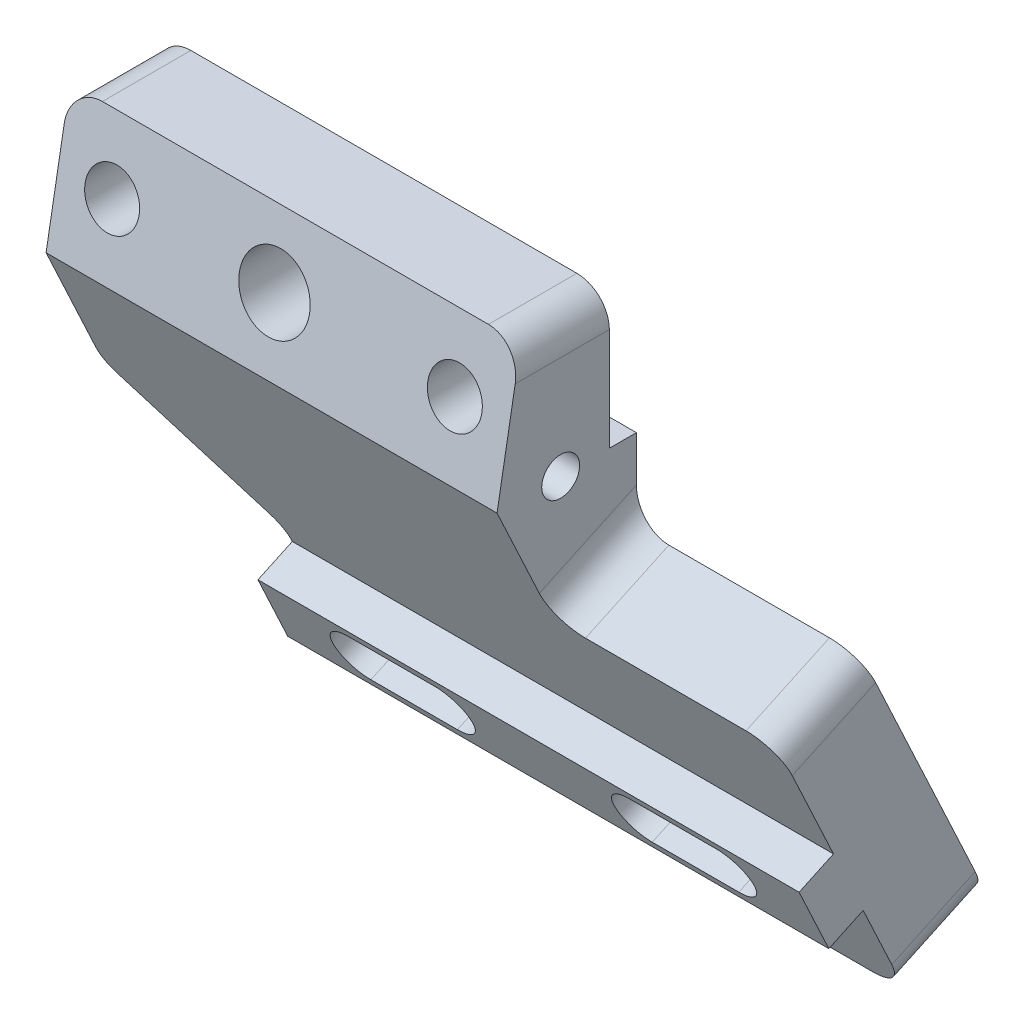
SolidWorks part; units mm, degrees
ref_plane "Front Plane" through (0, 0, 0) normal (0, 0, 1) x (1, 0, 0)
ref_plane "Top Plane" through (0, 0, 0) normal (0, 1, 0) x (1, 0, 0)
ref_plane "Right Plane" through (0, 0, 0) normal (1, 0, 0) x (0, 0, -1)
sketch "Sketch10" plane through (0, 0, 0) normal (1, 0, 0) x (0, 0, -1)
  line L0 (3.752, -2.0289) -> (3.752, 22.9711)
  line L1 (3.752, 22.9711) -> (-12.5918, 22.9711)
  line L2 (-12.5918, 22.9711) -> (-17, -2.0289)
  line L3 (-17, -2.0289) -> (16.8095, -74.5335)
  line L4 (16.8095, -74.5335) -> (32.2167, -67.349)
  line L5 (8.752, -17.0289) -> (32.2167, -67.349)
  line L6 (-17, -2.0289) -> (-46.0302, 60.2265) construction
  line L7 (3.752, -2.0289) -> (8.752, -2.0289)
  line L8 (8.752, -2.0289) -> (8.752, -17.0289)
  line L9 (32.2167, -67.349) -> (32.2167, 55.5953) construction
  line L10 (3.752, -2.0289) -> (-44.3046, -2.0289) construction
  dimension "D1" = 5
  dimension "D2" = 35
  dimension "D3" = 80
  dimension "D4" = 25
  dimension "D5" = 17
  dimension "D6" = 25
  dimension "D7" = 40
extrude "Extrude5" add sketch "Sketch10" along normal blind 125
sketch "Sketch11" plane through (0, 0.3108, -0.6664) normal (0, 0.4226, -0.9063) x (-1, 0, 0)
  line L0 (0, -19.1322) -> (-25, -40.1097)
  line L1 (-25, -40.1097) -> (-25, -74.6543)
  line L2 (-125, -74.6543) -> (0, -74.6543) construction
  line L3 (-125, -19.1322) -> (0, -19.1322) construction
  line L4 (-125, -74.6543) -> (-125, -19.1322) construction
  line L5 (0, -19.1322) -> (0, -74.6543)
  line L6 (0, -74.6543) -> (-25, -74.6543)
  dimension "D1" = 40
  dimension "D2" = 100
extrude "Cut-Extrude1" cut sketch "Sketch11" against normal up to surface (17 mm away)
ref_plane "Plane4" through (0, -17.3397, -8.0856) normal (0, -0.9063, -0.4226) x (1, 0, 0)
sketch "Sketch13" plane through (125, 0, 0) normal (1, 0, 0) x (0, 0, -1)
  line L0 (8.752, -17.0289) -> (-6.6552, -24.2134)
  line L1 (-22.1619, -31.4443) -> (38.3332, -3.235) construction
  line L2 (-17, -2.0289) -> (16.8095, -74.5335) construction
  line L3 (8.752, -17.0289) -> (8.752, -2.0289)
  line L4 (8.752, -2.0289) -> (3.752, -2.0289)
  line L5 (3.752, -2.0289) -> (3.752, 22.9711)
  line L6 (3.752, 22.9711) -> (-12.5918, 22.9711)
  line L7 (-12.5918, 22.9711) -> (-17, -2.0289)
  line L8 (-17, -2.0289) -> (-6.6552, -24.2134)
extrude "Cut-Extrude2" cut sketch "Sketch13" against normal blind 41.6667
fillet "Fillet1" radius 6 8 edges at (125, -70.9413, -24.5131) (125, -20.6212, -1.0484) (83.3333, -20.6212, -1.0484) (83.3333, 22.9711, 4.4199) (0, 22.9711, 4.4199) (0, -20.6212, -1.0484) (25, -39.6332, -9.9139) (25, -70.9413, -24.5131)
sketch "Sketch15" plane through (0, 0, 0) normal (-1, 0, 0) x (0, 0, 1)
  line L0 (17, -2.0289) -> (-3.752, -2.0289) construction
  circle A0 centre (5.248, -2.0289) radius 3.5
  dimension "D1" = 7
  dimension "D2" = 9
extrude "Cut-Extrude3" cut sketch "Sketch15" against normal through all
sketch "Sketch16" plane through (0, 0, -3.752) normal (0, 0, -1) x (-1, 0, 0)
  line L0 (0, -2.0289) -> (0, 16.9711) construction
  line L1 (-83.3333, -2.0289) -> (0, -2.0289) construction
  line L2 (4.5535, 10.4711) -> (-104.5608, 10.4711) construction
  line L3 (-83.3333, -2.0289) -> (-83.3333, 16.9711) construction
  circle A0 centre (-40, 10.4711) radius 6.5
  circle A1 centre (-10, 10.4711) radius 5
  circle A2 centre (-73.3333, 10.4711) radius 5
  dimension "D1" = 13
  dimension "D4" = 10
  dimension "D6" = 10
  dimension "D2" = 40
  dimension "D3" = 12.5
  dimension "D5" = 10
  dimension "D7" = 10
extrude "Cut-Extrude4" cut sketch "Sketch16" against normal through all
sketch "Sketch18" plane through (0, -6.8738, 14.7408) normal (0, -0.4226, 0.9063) x (1, 0, 0)
  line L0 (25, -49.6543) -> (125, -49.6543) construction
  line L1 (25, -56.1543) -> (125, -56.1543)
  line L2 (25, -43.1543) -> (125, -43.1543)
  line L3 (25, -56.1543) -> (25, -43.1543)
  line L4 (125, -56.1543) -> (125, -43.1543)
  line L5 (25, -68.6543) -> (25, -42.9075) construction
  line L6 (125, -25.1322) -> (125, -68.6543) construction
  dimension "D1" = 55
  dimension "D2" = 6.5
  dimension "D3" = 6.5
extrude "Extrude6" add sketch "Sketch18" along normal blind 7
sketch "Sketch17" plane through (0, 0.3108, -0.6664) normal (0, 0.4226, -0.9063) x (-1, 0, 0)
  line L0 (-109, -49.6543) -> (-93, -49.6543) construction
  line L1 (-57, -49.6543) -> (-41, -49.6543) construction
  line L2 (-109, -54.6543) -> (-93, -54.6543)
  line L3 (-109, -44.6543) -> (-93, -44.6543)
  line L4 (-125, -68.6543) -> (-125, -25.1322) construction
  line L5 (-57, -54.6543) -> (-41, -54.6543)
  line L6 (-57, -44.6543) -> (-41, -44.6543)
  line L7 (-25, -42.9075) -> (-25, -68.6543) construction
  arc A0 (-109, -54.6543) -> (-109, -44.6543) centre (-109, -49.6543) cw
  arc A1 (-93, -54.6543) -> (-93, -44.6543) centre (-93, -49.6543) ccw
  arc A2 (-57, -54.6543) -> (-57, -44.6543) centre (-57, -49.6543) cw
  arc A3 (-41, -54.6543) -> (-41, -44.6543) centre (-41, -49.6543) ccw
  dimension "D5" = 16
  dimension "D3" = 16
  dimension "D4" = 55
  dimension "D8" = 16
  dimension "D9" = 16
  dimension "D1" = 5
  dimension "D2" = 5
  dimension "D6" = 5
  dimension "D7" = 5
extrude "Cut-Extrude5" cut sketch "Sketch17" against normal through all
